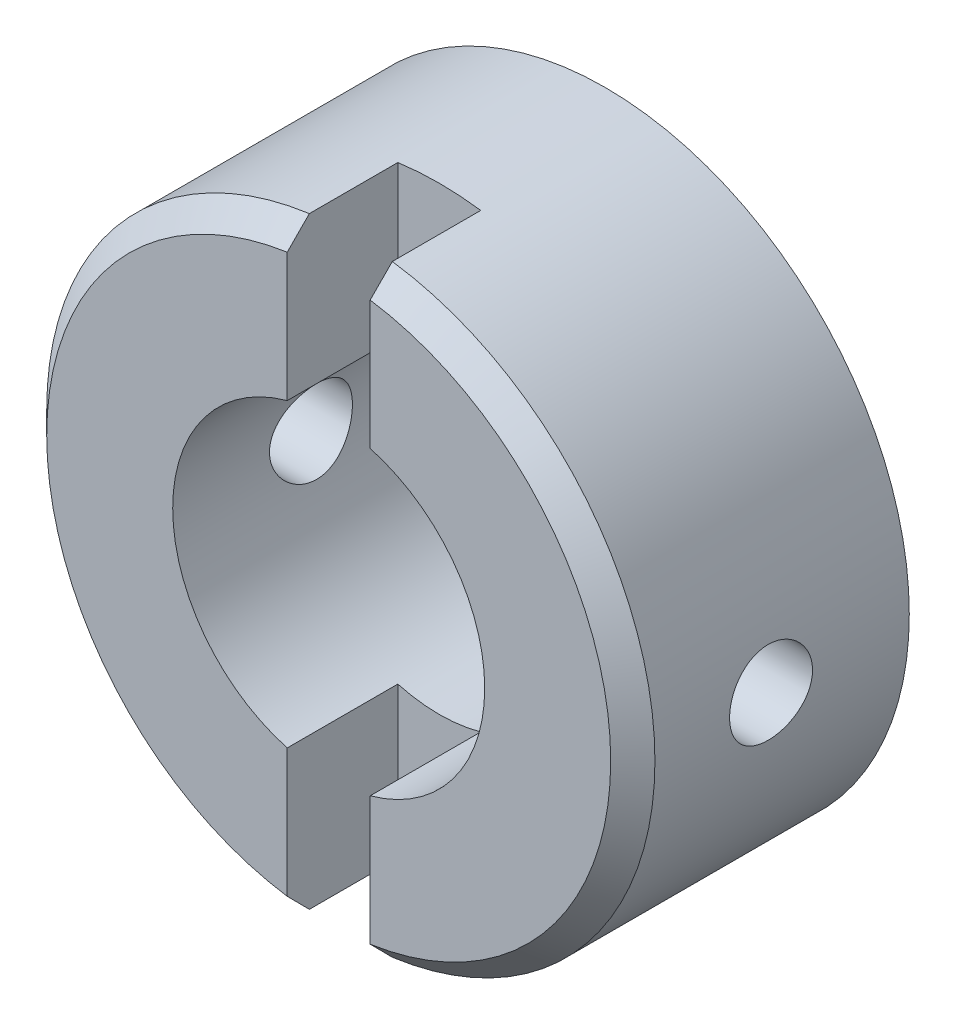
SolidWorks part; units mm, degrees
ref_plane "Front" through (0, 0, 0) normal (0, 0, 1) x (1, 0, 0)
ref_plane "Top" through (0, 0, 0) normal (0, 1, 0) x (1, 0, 0)
ref_plane "Right" through (0, 0, 0) normal (1, 0, 0) x (0, 0, -1)
sketch "Sketch1" plane through (0, 0, 0) normal (0, 0, 1) x (1, 0, 0)
  circle A0 centre (0, 0) radius 11
  circle A1 centre (0, 0) radius 5.6429
  dimension "D1" = 11.2857
  dimension "dk" = 22
extrude "BaseNut" add sketch "Sketch1" against normal blind 10
chamfer "Chamfer1" distance 0.8 angle 45 1 edges at (11, 0, 0)
sketch "Sketch2" plane through (-6.0929, -5.3641, 0) normal (0, 0, 1) x (1, 0, 0)
  line L0 (6.0929, 17.6245) -> (6.0929, -7.073) construction
  line L1 (4.5929, 16.2613) -> (4.5929, -5.5332)
  line L2 (7.5929, 16.2613) -> (7.5929, -5.5332)
  arc A1 (7.5929, 16.2613) -> (4.5929, 16.2613) centre (6.0929, 5.3641) ccw
  arc A2 (4.5929, -5.5332) -> (7.5929, -5.5332) centre (6.0929, 5.3641) ccw
  circle A3 centre (6.0929, 5.3641) radius 11 construction
  dimension "n" = 3
extrude "Cut-Extrude1" cut sketch "Sketch2" against normal offset from surface (4 mm away) 6
sketch "Sketch3" plane through (0, 0, 0) normal (1, 0, 0) x (0, 0, -1)
  line L4 (10, -11) -> (10, 11) construction
  circle A0 centre (5, 0) radius 1.5
  dimension "d2" = 3
  dimension "K" = 5
extrude "Cut-Extrude2" cut sketch "Sketch3" against normal through all and the other way through all
chamfer "EndChamfer" distance 0.4 angle 45 1 edges at (5.6429, 0, -10)
sketch "Sketch4" plane through (0, 0, 0) normal (0, 1, 0) x (1, 0, 0)
  line L0 (4.7857, 10.0286) -> (4.7857, 9.1714)
  line L1 (4.7857, 9.1714) -> (5.6429, 9.1714)
  line L2 (5.6429, 9.1714) -> (6.3852, 9.6)
  line L3 (6.3852, 9.6) -> (5.6429, 10.0286)
  line L4 (5.6429, 10.0286) -> (4.7857, 10.0286)
  line L5 (0, 13.0642) -> (0, -2.5632) construction
  line L7 (5.6429, 9.6) -> (-5.6429, 9.6) construction
  dimension "D1" = 0.8571
  dimension "D2" = 11.2857
revolve "Cut-Revolve10" [suppressed] cut sketch "Sketch4" angle 360 about L5
pattern_linear "LPattern10" [suppressed] count 10 spacing 1.0286 along (0, 0, 1)
equation "\"D1@EndChamfer\" = \"C@Chamfer1\" / 2"
equation "\"D2@ThreadCosmetic3\" = \"D2@ThreadCosmetic2\""
equation "\"D1@Sketch4\" =  ( \"D2@ThreadCosmetic1\" - \"D1@Sketch1\" )  / 2"
equation "\"D3@LPattern10\" = \"D1@Sketch4\" * 1.2"
equation "\"D1@LPattern10\" = \"m@BaseNut\" / \"D3@LPattern10\""
equation " \"D2@Sketch4\"=\"D1@Sketch1\" "
